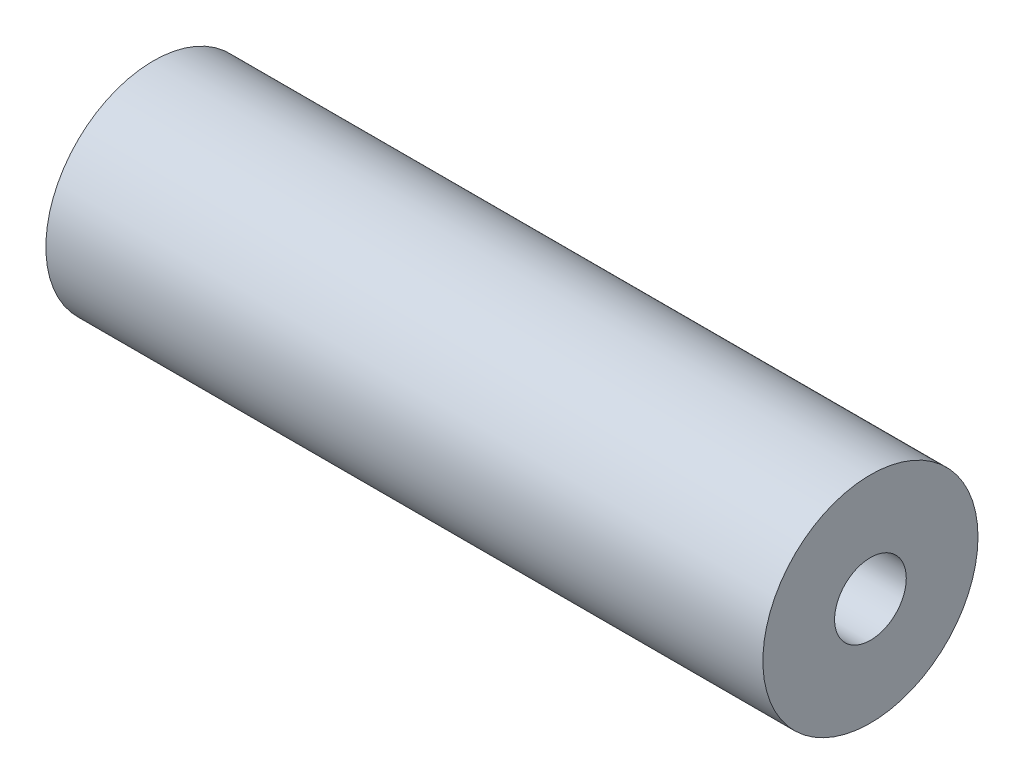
SolidWorks part; units mm, degrees
ref_plane "Front Plane" through (0, 0, 0) normal (0, 0, 1) x (1, 0, 0)
ref_plane "Top Plane" through (0, 0, 0) normal (0, 1, 0) x (1, 0, 0)
ref_plane "Right Plane" through (0, 0, 0) normal (1, 0, 0) x (0, 0, -1)
sketch "Sketch1" plane through (0, 0, 0) normal (1, 0, 0) x (0, 0, -1)
  circle A0 centre (0, 0) radius 7.5
  circle A1 centre (0, 0) radius 2.5
  dimension "D1" = 5
  dimension "D2" = 15
extrude "Boss-Extrude1" add sketch "Sketch1" along normal blind 50
